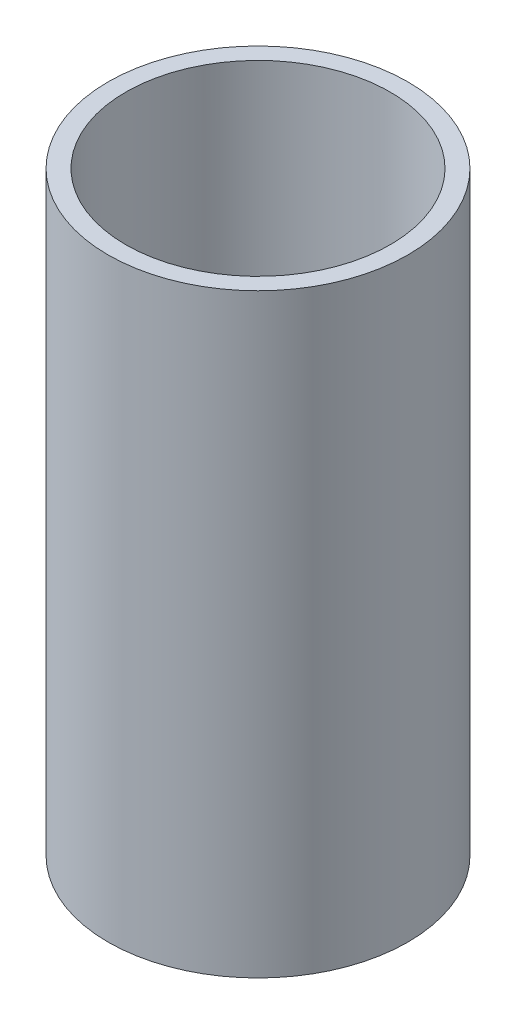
SolidWorks part; units mm, degrees
ref_plane "Front Plane" through (0, 0, 0) normal (0, 0, 1) x (1, 0, 0)
ref_plane "Top Plane" through (0, 0, 0) normal (0, 1, 0) x (1, 0, 0)
ref_plane "Right Plane" through (0, 0, 0) normal (1, 0, 0) x (0, 0, -1)
sketch "Sketch1" plane through (0, 0, 0) normal (0, 1, 0) x (1, 0, 0)
  circle A0 centre (0, 0) radius 43.18
extrude "Boss-Extrude1" add sketch "Sketch1" along normal blind 171.45
sketch "Sketch2" plane through (0, 171.45, 0) normal (0, 1, 0) x (1, 0, 0)
  circle A0 centre (0, 0) radius 38.1
extrude "Cut-Extrude1" cut sketch "Sketch2" against normal through all
ref_plane "Plane1" through (38.1, 0, 0) normal (-1, 0, 0) x (0, 0, 1)
sketch "Sketch3" plane through (38.1, 0, 0) normal (-1, 0, 0) x (0, 0, 1)
  line L1 (-6.35, 0) -> (6.35, 0)
  line L2 (-6.35, 0) -> (-6.35, 6.35)
  line L3 (-6.35, 6.35) -> (6.35, 6.35)
  line L4 (6.35, 0) -> (6.35, 6.35)
extrude "Boss-Extrude2" add sketch "Sketch3" along normal blind 2.54
